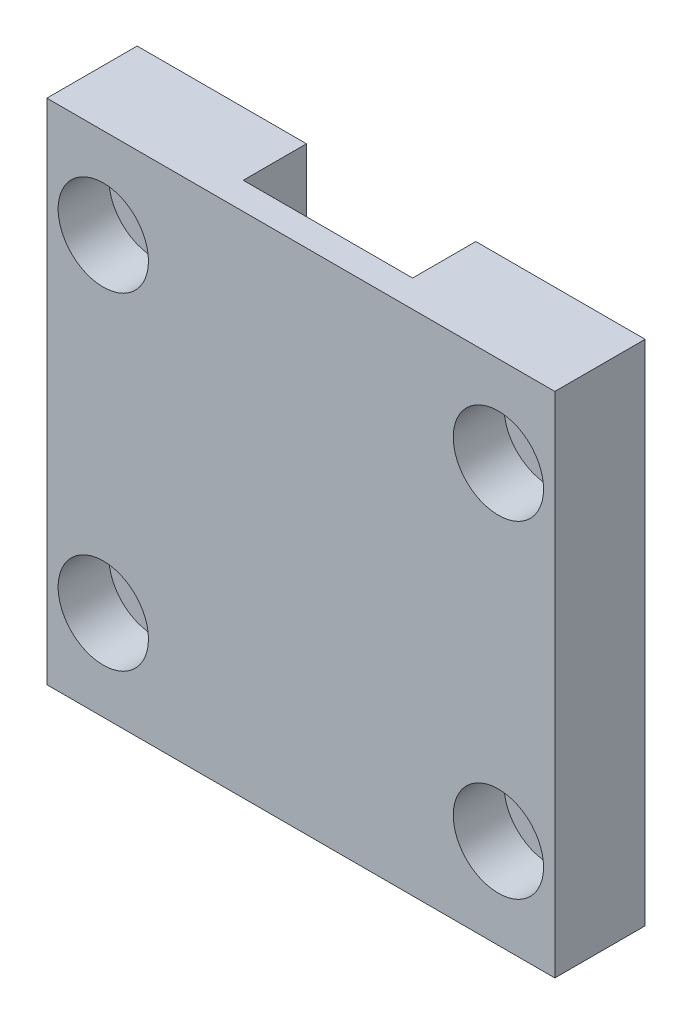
SolidWorks part; units mm, degrees
ref_plane "前视基准面" through (0, 0, 0) normal (0, 0, 1) x (1, 0, 0)
ref_plane "上视基准面" through (0, 0, 0) normal (0, 1, 0) x (1, 0, 0)
ref_plane "右视基准面" through (0, 0, 0) normal (1, 0, 0) x (0, 0, -1)
sketch "草图1" plane through (0, 0, 0) normal (0, 0, 1) x (1, 0, 0)
  line L0 (0, 45) -> (45, 45)
  line L1 (0, 0) -> (45, 0)
  line L2 (0, 0) -> (0, 45)
  line L3 (45, 0) -> (45, 45)
  circle A0 centre (5, 8) radius 2.25
  circle A1 centre (40, 8) radius 2.25
  circle A2 centre (5, 37) radius 2.25
  circle A3 centre (40, 37) radius 2.25
extrude "凸台-拉伸1" add sketch "草图1" along normal blind 8
sketch "草图2" plane through (0, 0, 8) normal (0, 0, 1) x (1, 0, 0)
  circle A0 centre (5, 8) radius 4
  circle A1 centre (40, 8) radius 4
  circle A2 centre (5, 37) radius 4
  circle A3 centre (40, 37) radius 4
extrude "切除-拉伸1" cut sketch "草图2" against normal blind 4.5
sketch "草图3" plane through (0, 45, 0) normal (0, 1, 0) x (1, 0, 0)
  line L0 (0, 0) -> (15, 0)
  line L1 (0, -8) -> (45, -8)
  line L2 (0, -8) -> (0, 0)
  line L3 (45, -8) -> (45, 0)
  line L4 (15, -5.6) -> (30, -5.6)
  line L5 (15, -5.6) -> (15, 0)
  line L6 (30, -5.6) -> (30, 0)
  line L7 (30, 0) -> (45, 0)
extrude "切除-拉伸2" cut sketch "草图3" against normal through all flip side to cut
